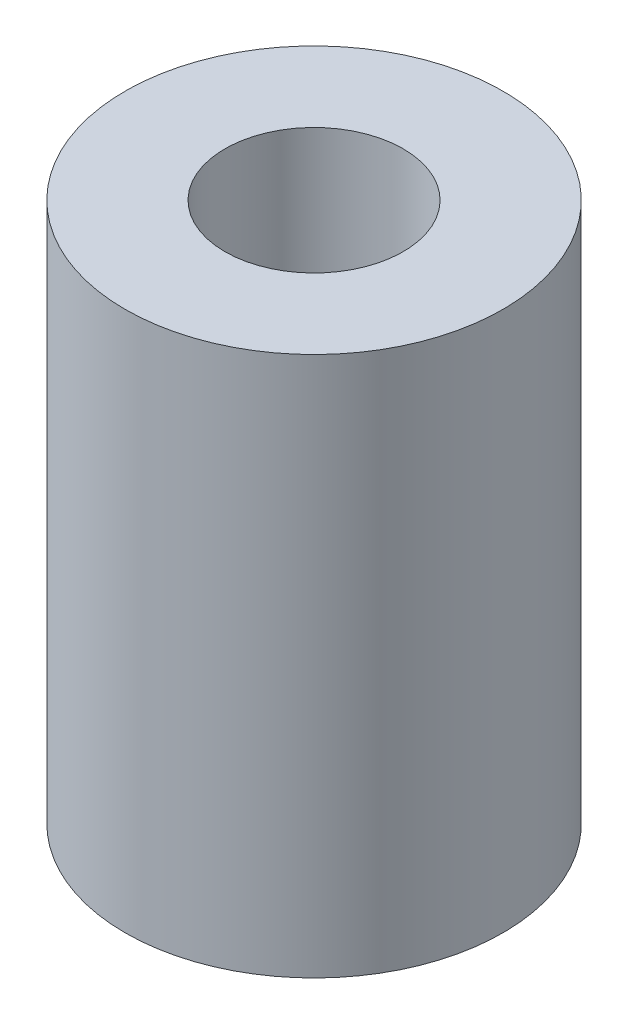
SolidWorks part; units mm, degrees
ref_plane "Front Plane" through (0, 0, 0) normal (0, 0, 1) x (1, 0, 0)
ref_plane "Top Plane" through (0, 0, 0) normal (0, 1, 0) x (1, 0, 0)
ref_plane "Right Plane" through (0, 0, 0) normal (1, 0, 0) x (0, 0, -1)
sketch "Sketch1" plane through (0, 0, 0) normal (0, 1, 0) x (1, 0, 0)
  line L0 (-3.0665, 2.667) -> (3.0665, 2.667)
  arc A0 (-3.0665, 2.667) -> (3.0665, 2.667) centre (0, 0) ccw
  circle A1 centre (0, 0) radius 7
  dimension "D1" = 8.128
  dimension "D3" = 14
  dimension "D2" = 2.667
extrude "Boss-Extrude1" add sketch "Sketch1" along normal blind 10
sketch "Sketch2" plane through (0, 10, 0) normal (0, 1, 0) x (1, 0, 0)
  circle A0 centre (0, 0) radius 7
extrude "Boss-Extrude2" add sketch "Sketch2" along normal blind 2
fillet "Fillet1" radius 2 2 edges at (0, 10, -2.667) (0, 10, 4.064)
sketch "Sketch3" plane through (0, 12, 0) normal (0, 1, 0) x (1, 0, 0)
  line L0 (-3.2941, 0.2286) -> (3.2941, 0.2286)
  line L1 (-3.2941, -0.2286) -> (3.2941, -0.2286)
  line L2 (-0.5309, 0.2286) -> (-0.5309, -0.2286) construction
  arc A0 (-3.2941, 0.2286) -> (-3.2941, -0.2286) centre (0, 0) ccw
  arc A1 (3.2941, -0.2286) -> (3.2941, 0.2286) centre (0, 0) ccw
  point P7 (-0.5309, 0)
  dimension "D1" = 6.604
  dimension "D2" = 0.4572
extrude "Boss-Extrude3" add sketch "Sketch3" along normal blind 1.6
sketch "Sketch4" plane through (0, 12, 0) normal (0, 1, 0) x (1, 0, 0)
  circle A0 centre (0, 0) radius 3.302
  circle A1 centre (0, 0) radius 7
  arc A2 (-3.2941, 0.2286) -> (-3.2941, -0.2286) centre (0, 0) ccw construction
  circle A3 centre (0, 0) radius 7 construction
extrude "Boss-Extrude4" add sketch "Sketch4" along normal blind 8
fillet "Fillet2" radius 0.2 2 edges at (0, 12, 3.302) (0, 12, -3.302)
